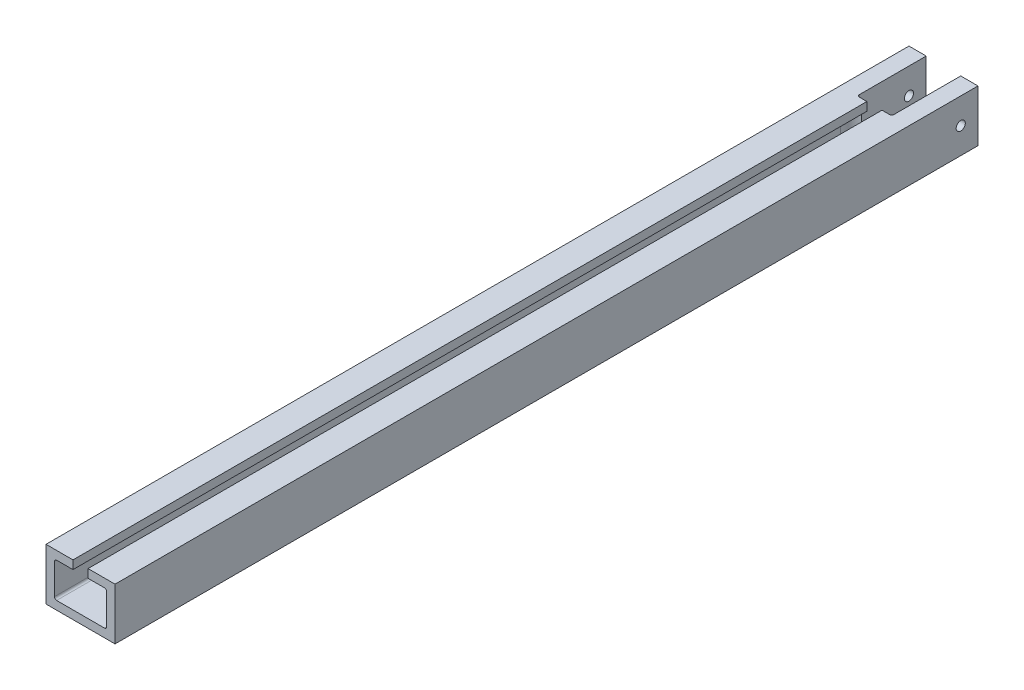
SolidWorks part; units mm, degrees
ref_plane "Front Plane" through (0, 0, 0) normal (0, 0, 1) x (1, 0, 0)
ref_plane "Top Plane" through (0, 0, 0) normal (0, 1, 0) x (1, 0, 0)
ref_plane "Right Plane" through (0, 0, 0) normal (1, 0, 0) x (0, 0, -1)
sketch "Sketch1" plane through (0, 0, 0) normal (1, 0, 0) x (0, 0, -1)
  line L0 (0, 0) -> (-862.1046, 862.1046) construction
  line L1 (-359.2102, 359.2102) -> (-718.4205, 0) construction
  line L2 (-718.4205, 0) -> (0, 0) construction
  dimension "D1" = 1219.2
  dimension "D2" = 508
  dimension "D3" = 508
  dimension "D4" = 45
sketch "Sketch2" plane through (0, 0, 0) normal (1, 0, 0) x (0, 0, -1)
  line L0 (-718.4205, 0) -> (0, 0) construction
  line L1 (-1244.6, -38.1) -> (25.4, -38.1)
  line L2 (-1244.6, -38.1) -> (-1244.6, 38.1)
  line L3 (-1244.6, 38.1) -> (25.4, 38.1)
  line L4 (25.4, -38.1) -> (25.4, 38.1)
  line L5 (-1244.6, -38.1) -> (25.4, 38.1) construction
  line L6 (-1244.6, 38.1) -> (25.4, -38.1) construction
  point P0 (-609.6, 0)
  dimension "D1" = 76.2
  dimension "D2" = 1270
  dimension "D3" = 25.4
extrude "Boss-Extrude1" add sketch "Sketch2" along normal mid plane 101.6
sketch "Sketch3" plane through (0, 0, -25.4) normal (0, 0, -1) x (-1, 0, 0)
  line L0 (-50.8, 38.1) -> (50.8, 38.1) construction
  line L1 (-25.4, 38.1) -> (25.4, 38.1)
  line L2 (-25.4, 38.1) -> (-25.4, -28.575)
  line L3 (-25.4, -28.575) -> (25.4, -28.575)
  line L4 (25.4, 38.1) -> (25.4, -28.575)
  point P4 (0, 38.1)
  dimension "D1" = 50.8
  dimension "D2" = 66.675
extrude "Cut-Extrude1" cut sketch "Sketch3" against normal blind 101.6
sketch "Sketch4" plane through (0, 0, 76.2) normal (0, 0, -1) x (-1, 0, 0)
  line L0 (-11.1125, 21.4189) -> (-11.1125, 38.1)
  line L1 (-11.1125, 38.1) -> (11.1125, 38.1)
  line L2 (11.1125, 38.1) -> (11.1125, 21.4189)
  line L3 (0, 0) -> (0, 38.1) construction
  line L4 (25.4, 38.1) -> (-25.4, 38.1) construction
  circle A0 centre (0, 0) radius 24.13 construction
  arc A1 (11.1125, 21.4189) -> (-11.1125, 21.4189) centre (0, 0) cw
  dimension "D1" = 48.26
  dimension "D2" = 22.225
extrude "Cut-Extrude2" cut sketch "Sketch4" against normal through all
sketch "Sketch5" plane through (50.8, 0, 0) normal (1, 0, 0) x (0, 0, -1)
  circle A0 centre (0, 0) radius 6.731
  dimension "D1" = 13.462
extrude "Cut-Extrude3" cut sketch "Sketch5" against normal through all
fillet "Fillet1" radius 3.175 5 edges at (-25.4, -28.575, 25.4) (25.4, -28.575, 25.4) (0, -28.575, 76.2) (25.4, 4.7625, 76.2) (-25.4, 4.7625, 76.2)
sketch "Sketch6" [suppressed] plane through (0, 0, 0) normal (1, 0, 0) x (0, 0, -1)
  circle A0 centre (0, 0) radius 6.35
  dimension "D1" = 12.7
extrude "Boss-Extrude2" [suppressed] add sketch "Sketch6" along normal mid plane 77.7875 separate body
sketch "Sketch7" [suppressed] plane through (38.8937, 0, 0) normal (1, 0, 0) x (0, 0, -1)
  circle A0 centre (0, 0) radius 7.9375
  dimension "D1" = 15.875
extrude "Boss-Extrude3" [suppressed] add sketch "Sketch7" along normal blind 1.5875
mirror "Mirror1" [suppressed] about plane through (0, 0, 0) normal (1, 0, 0)
sketch "Sketch8" plane through (0, 0, 1244.6) normal (0, 0, 1) x (1, 0, 0)
  line L1 (-38.354, -25.654) -> (38.354, -25.654)
  line L2 (-38.354, -25.654) -> (-38.354, 25.654)
  line L3 (-38.354, 25.654) -> (38.354, 25.654)
  line L4 (38.354, -25.654) -> (38.354, 25.654)
  line L5 (-38.354, -25.654) -> (38.354, 25.654) construction
  line L6 (-38.354, 25.654) -> (38.354, -25.654) construction
  point P0 (0, 0)
  dimension "D1" = 76.708
  dimension "D2" = 51.308
extrude "Cut-Extrude4" cut sketch "Sketch8" against normal blind 1174.75
fillet "Fillet2" radius 19.05 2 edges at (38.354, 0, 69.85) (-38.354, 0, 69.85)
fillet "Fillet3" radius 3.175 8 edges at (34.7803, -25.654, 76.7903) (34.7803, 25.654, 76.7903) (-34.7803, 25.654, 76.7903) (-38.354, -25.654, 666.2492) (38.354, -25.654, 666.2492) (38.354, 25.654, 666.2492) (-38.354, 25.654, 666.2492) (-34.7803, -25.654, 76.7903)
sketch "Sketch9" [suppressed] plane through (50.8, 0, 0) normal (1, 0, 0) x (0, 0, -1)
  line L0 (-939.8, 38.1) -> (-939.8, -38.1)
  line L1 (25.4, 38.1) -> (-1244.6, 38.1) construction
  line L2 (-1244.6, -38.1) -> (25.4, -38.1) construction
  line L3 (-863.6, -38.1) -> (-863.6, 38.1)
  line L4 (-1244.6, 38.1) -> (-1244.6, -38.1) construction
  dimension "D1" = 304.8
  dimension "D2" = 381
